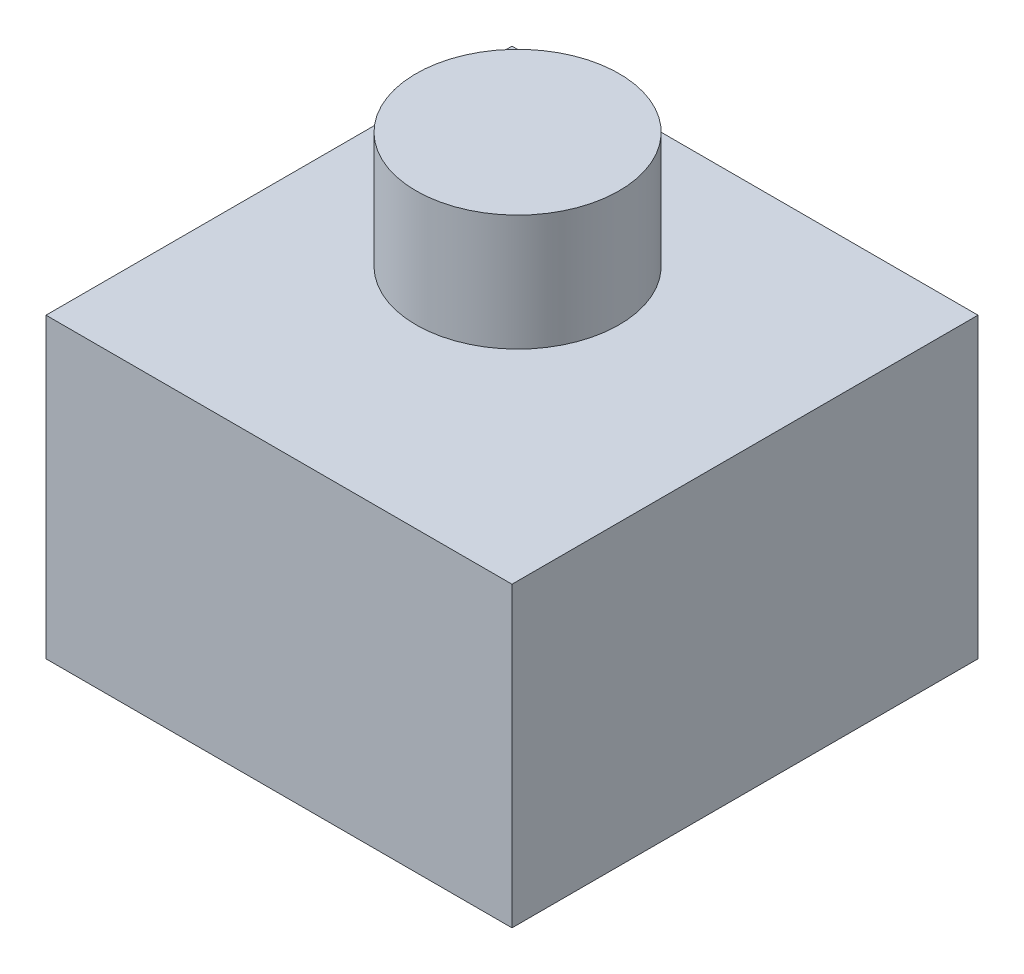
SolidWorks part; units mm, degrees
ref_plane "Front Plane" through (0, 0, 0) normal (0, 0, 1) x (1, 0, 0)
ref_plane "Top Plane" through (0, 0, 0) normal (0, 1, 0) x (1, 0, 0)
ref_plane "Right Plane" through (0, 0, 0) normal (1, 0, 0) x (0, 0, -1)
sketch "Sketch1" plane through (0, 0, 0) normal (0, 1, 0) x (1, 0, 0)
  line L0 (48.7636, -48.7636) -> (-48.7636, 48.7636) construction
  line L1 (-48.7636, 48.7636) -> (48.7636, 48.7636)
  line L2 (-48.7636, 48.7636) -> (-48.7636, -48.7636)
  line L3 (-48.7636, -48.7636) -> (48.7636, -48.7636)
  line L4 (48.7636, 48.7636) -> (48.7636, -48.7636)
extrude "Extrude1" add sketch "Sketch1" along normal blind 62.2905
sketch "Sketch2" plane through (0, 62.2905, 0) normal (0, 1, 0) x (-1, 0, 0)
  circle A0 centre (8.2833, -9.453) radius 21.2536
extrude "Extrude2" add sketch "Sketch2" along normal blind 24.2905
